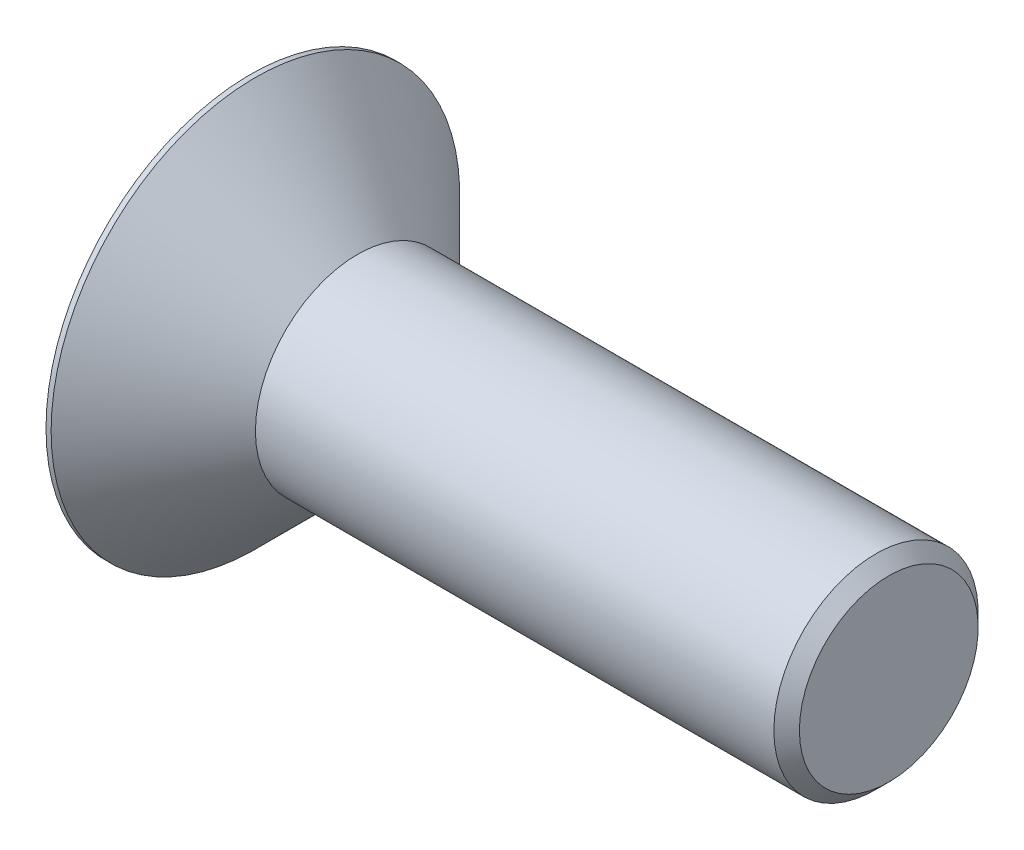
SolidWorks part; units mm, degrees
ref_plane "Ebene vorne" through (0, 0, 0) normal (0, 0, 1) x (1, 0, 0)
ref_plane "Ebene oben" through (0, 0, 0) normal (0, 1, 0) x (1, 0, 0)
ref_plane "Ebene rechts" through (0, 0, 0) normal (1, 0, 0) x (0, 0, -1)
sketch "Skizze1" plane through (0, 0, 0) normal (0, 0, 1) x (1, 0, 0)
  line L0 (0, 0) -> (2554.3716, 0) construction
  line L1 (0, -1000) -> (0, 8) construction
  line L2 (0, 0) -> (0, 8)
  line L3 (0.2, 8) -> (4.2, 4)
  line L4 (4.2, 4) -> (25, 4)
  line L5 (25, 4) -> (25, 0)
  line L6 (25, 0) -> (0, 0)
  line L7 (0, 8) -> (0.2, 8)
  point P7 (0, 4)
  dimension "D1" = 8
  dimension "D2" = 4.2
  dimension "D3" = 16
  dimension "D4" = 25
  dimension "D5" = 45
revolve "Rotation1" add sketch "Skizze1" angle 360 about L0
chamfer "Fase1" distance 0.5 angle 45 1 edges at (25, 0, 4)
sketch "Skizze2" plane through (0, 0, 0) normal (-1, 0, 0) x (0, 0, 1)
  line L1 (2.3377, 1.6936) -> (-0.2979, 2.8713)
  line L2 (-0.2979, 2.8713) -> (-2.6356, 1.1777)
  line L3 (-2.6356, 1.1777) -> (-2.3377, -1.6936)
  line L4 (-2.3377, -1.6936) -> (0.2979, -2.8713)
  line L5 (0.2979, -2.8713) -> (2.6356, -1.1777)
  line L6 (2.6356, -1.1777) -> (2.3377, 1.6936)
  circle A0 centre (0, 0) radius 2.5 construction
  dimension "D1" = 5
extrude "Schnitt-Linear austragen1" cut sketch "Skizze2" against normal blind 2.5
